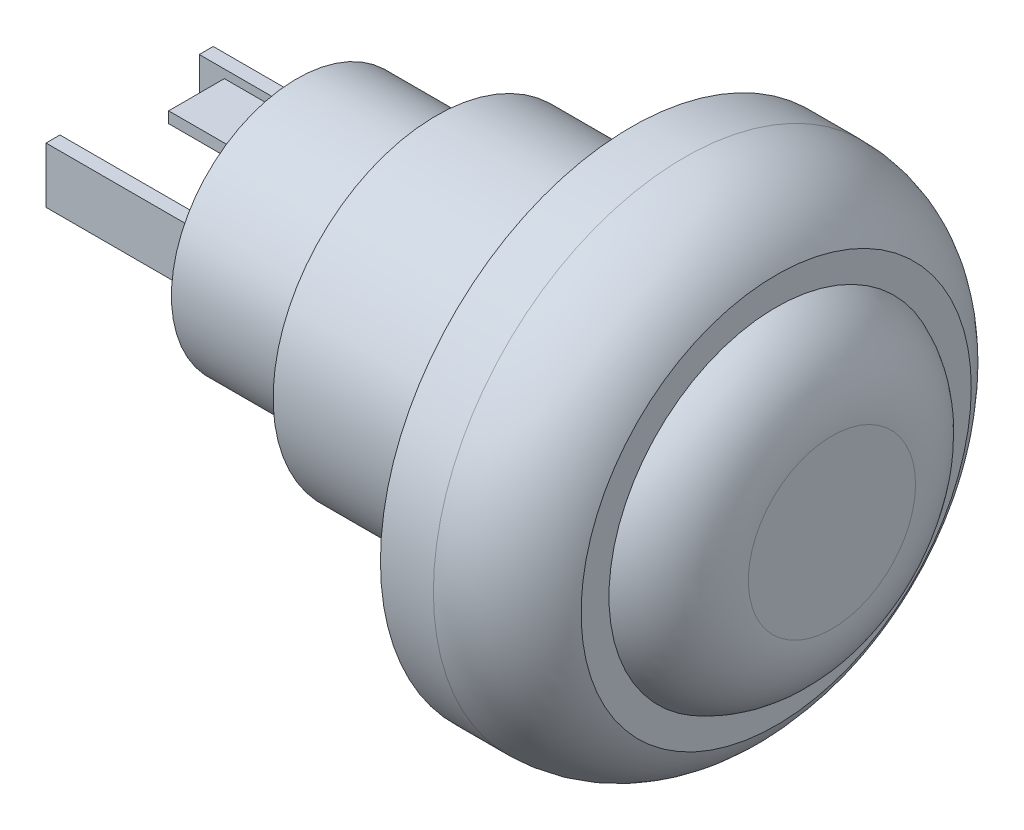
SolidWorks part; units mm, degrees
ref_plane "Přední" through (0, 0, 0) normal (0, 0, 1) x (1, 0, 0)
ref_plane "Horní" through (0, 0, 0) normal (0, 1, 0) x (1, 0, 0)
ref_plane "Pravá" through (0, 0, 0) normal (1, 0, 0) x (0, 0, -1)
sketch "Skica1" plane through (0, 0, 0) normal (0, 0, 1) x (1, 0, 0)
  line L0 (0, 0) -> (0, 4.5)
  line L1 (0, 4.5) -> (5, 4.5)
  line L2 (5, 4.5) -> (5, 5.85)
  line L3 (5, 5.85) -> (11, 5.85)
  line L4 (11, 5.85) -> (11, 6.75)
  line L5 (11, 6.75) -> (12, 6.75)
  line L6 (12, 6.75) -> (12, 9)
  line L7 (12, 9) -> (13.9, 9)
  line L8 (17.2, 7) -> (17.2, 6)
  line L9 (0, 0) -> (-11.2527, 0) construction
  line L13 (19.2, 3) -> (19.2, 0)
  line L14 (19.2, 0) -> (0, 0)
  arc A0 (13.9, 9) -> (17.2, 7) centre (13.9, 5.2775) cw
  arc A1 (17.2, 6) -> (19.2, 3) centre (16.0471, 3.0647) cw
  dimension "D13" = 2
  dimension "D1" = 9
  dimension "D2" = 11.7
  dimension "D3" = 13.5
  dimension "D4" = 18
  dimension "D5" = 5
  dimension "D6" = 6
  dimension "D7" = 1
  dimension "D8" = 1.9
  dimension "D9" = 5.2
  dimension "D10" = 14
  dimension "D11" = 12
  dimension "D14" = 6
revolve "Rotovat1" add sketch "Skica1" angle 360 about L9
sketch "Skica2" plane through (0, 0, 0) normal (-1, 0, 0) x (0, 0, 1)
  line L0 (-2.5, 0) -> (0, 0) construction
  line L1 (-3, 1) -> (-2.5, 1)
  line L2 (-3, 1) -> (-3, -1)
  line L3 (-3, -1) -> (-2.5, -1)
  line L4 (-2.5, 1) -> (-2.5, -1)
  line L5 (0, 0) -> (0, 2.7021) construction
  line L6 (0, 0) -> (2.5, 0) construction
  line L8 (2.5, 1) -> (3, 1)
  line L9 (2.5, 1) -> (2.5, -1)
  line L10 (2.5, -1) -> (3, -1)
  line L11 (3, 1) -> (3, -1)
  dimension "D1" = 0.5
  dimension "D2" = 2
  dimension "D3" = 6
extrude "Vysunout1" add sketch "Skica2" along normal blind 6
sketch "Skica3" plane through (0, 0, 0) normal (-1, 0, 0) x (0, 0, 1)
  line L0 (0, 0) -> (0, 2) construction
  line L2 (1, 1.8) -> (-1, 1.8)
  line L3 (1, 1.8) -> (1, 2.2)
  line L4 (1, 2.2) -> (-1, 2.2)
  line L5 (-1, -1.8) -> (1, -1.8)
  line L6 (-1, -1.8) -> (-1, -2.2)
  line L7 (-1, -2.2) -> (1, -2.2)
  line L8 (1, -1.8) -> (1, -2.2)
  line L9 (0, 0) -> (0, -2) construction
  line L10 (-1, 1.8) -> (-1, 2.2)
  line L11 (1, 1.8) -> (-1, 2.2) construction
  line L12 (1, 2.2) -> (-1, 1.8) construction
  line L13 (-1, -1.8) -> (1, -2.2) construction
  line L14 (-1, -2.2) -> (1, -1.8) construction
extrude "Přidat vysunutím1" add sketch "Skica3" along normal blind 3.6
sketch "Skica4" plane through (11, 0, 0) normal (-1, 0, 0) x (0, 0, 1)
  line L0 (-3.1111, 5.9903) -> (3.493, 5.7759)
  circle A0 centre (0, 0) radius 6.75 construction
extrude "Odebrat vysunutím14" cut sketch "Skica4" along direction (-1, 0, 0) on the side against the normal up to surface (1 mm away) from surface at 0 contours L0 M3
